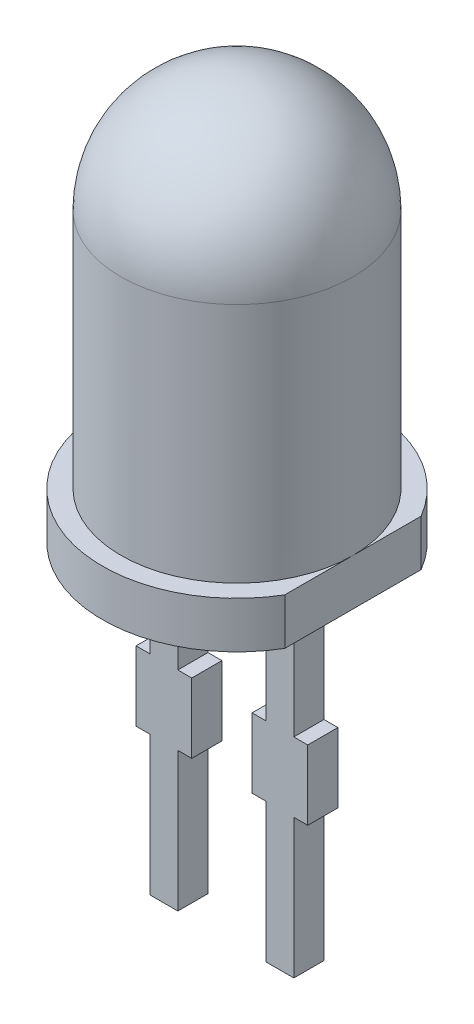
SolidWorks part; units mm, degrees
ref_plane "Front" through (0, 0, 0) normal (0, 0, 1) x (1, 0, 0)
ref_plane "Top" through (0, 0, 0) normal (0, 1, 0) x (1, 0, 0)
ref_plane "Right" through (0, 0, 0) normal (1, 0, 0) x (0, 0, -1)
sketch "Эскиз1" plane through (0, 0, 0) normal (0, 0, 1) x (1, 0, 0)
  line L0 (0, 4.2) -> (0, 12.9) construction
  line L1 (2.5, 10.4) -> (2.5, 5.2)
  line L2 (2.5, 5.2) -> (2.9, 5.2)
  line L3 (2.9, 5.2) -> (2.9, 4.2)
  line L4 (2.9, 4.2) -> (0, 4.2)
  line L5 (0, 4.2) -> (0, 12.9)
  line L6 (0, 0) -> (0, 4.2) construction
  arc A0 (0, 12.9) -> (2.5, 10.4) centre (0, 10.4) cw
  dimension "D1" = 5
  dimension "D2" = 5.8
  dimension "D3" = 8.7
  dimension "D4" = 1
  dimension "D5" = 12.9
revolve "Повернуть1" add sketch "Эскиз1" angle 360 about L0
sketch "Эскиз3" plane through (0, 5.2, 0) normal (0, 1, 0) x (1, 0, 0)
  line L0 (2.5, 1.4697) -> (2.5, -1.4697)
  circle A0 centre (0, 0) radius 2.9 construction
  arc A1 (2.5, -1.4697) -> (2.5, 1.4697) centre (0, 0) ccw
  circle A2 centre (0, 0) radius 2.5 construction
extrude "Вытянуть2" cut sketch "Эскиз3" against normal blind 1
sketch "Эскиз2" plane through (0, 0, 0) normal (0, 0, 1) x (1, 0, 0)
  line L0 (0, 0) -> (0, -3) construction
  line L1 (-1.25, 4.2) -> (-1.25, -3) construction
  line L2 (-2.9, 4.2) -> (2.5, 4.2) construction
  line L3 (-1.55, 4.2) -> (-1.55, 1.5)
  line L4 (-1.55, 1.5) -> (-1.85, 1.5)
  line L5 (-1.85, 1.5) -> (-1.85, 0)
  line L6 (-1.85, 0) -> (-1.55, 0)
  line L7 (-1.55, 0) -> (-1.55, -3)
  line L8 (-1.55, -3) -> (-0.95, -3)
  line L9 (-1.55, 4.2) -> (-0.95, 4.2)
  line L10 (-0.95, 0) -> (-0.95, -3)
  line L11 (-0.65, 0) -> (-0.95, 0)
  line L12 (-0.65, 1.5) -> (-0.65, 0)
  line L13 (-0.95, 1.5) -> (-0.65, 1.5)
  line L14 (-0.95, 4.2) -> (-0.95, 1.5)
  line L15 (0.95, 4.2) -> (0.95, 1.5)
  line L16 (0.95, 1.5) -> (0.65, 1.5)
  line L17 (0.65, 1.5) -> (0.65, 0)
  line L18 (0.65, 0) -> (0.95, 0)
  line L19 (0.95, 0) -> (0.95, -3)
  line L20 (1.55, 4.2) -> (0.95, 4.2)
  line L21 (1.55, -3) -> (0.95, -3)
  line L22 (1.55, 0) -> (1.55, -3)
  line L23 (1.85, 0) -> (1.55, 0)
  line L24 (1.85, 1.5) -> (1.85, 0)
  line L25 (1.55, 1.5) -> (1.85, 1.5)
  line L26 (1.55, 4.2) -> (1.55, 1.5)
  line L27 (1.25, -3) -> (1.25, 4.2) construction
  dimension "D1" = 0.6
  dimension "D2" = 1.2
  dimension "D4" = 1.5
  dimension "D5" = 3
  dimension "D6" = 2.5
extrude "Вытянуть1" add sketch "Эскиз2" along normal mid plane 0.65
fillet "Скругление1" radius 0.5 8 edges at (-1.25, 4.2, 0.325) (1.25, 4.2, 0.325) (1.55, 4.2, 0) (1.25, 4.2, -0.325) (0.95, 4.2, 0) (-0.95, 4.2, 0) (-1.25, 4.2, -0.325) (-1.55, 4.2, 0)
